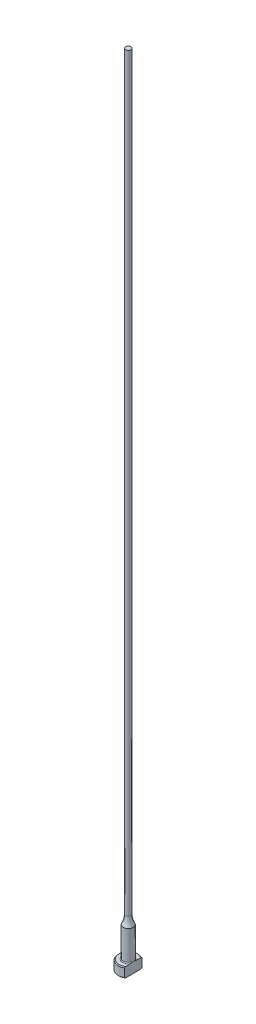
SolidWorks part; units mm, degrees
ref_plane "Front Plane" through (0, 0, 0) normal (0, 0, 1) x (1, 0, 0)
ref_plane "Top Plane" through (0, 0, 0) normal (0, 1, 0) x (1, 0, 0)
ref_plane "Right Plane" through (0, 0, 0) normal (1, 0, 0) x (0, 0, -1)
sketch "Sketch1" plane through (0, 0, 0) normal (0, 0, 1) x (1, 0, 0)
  line L0 (0, 259.9588) -> (0, -15.1925) construction
  line L1 (0, 0) -> (-3.175, 0)
  line L2 (-3.175, 0) -> (-3.175, 3.175)
  line L3 (-3.175, 3.175) -> (-1.5875, 3.175)
  line L4 (-0.8572, 15.6565) -> (-0.8572, 254)
  line L5 (-0.8572, 254) -> (0, 254)
  line L6 (0, 254) -> (0, 0)
  line L7 (-1.5875, 3.175) -> (-1.5875, 12.7)
  arc A0 (-1.5875, 12.7) -> (-0.8572, 15.6565) centre (-7.2072, 15.6565) ccw
  point P13 (-1.5875, 0)
  dimension "D1" = 6.35
  dimension "L" = 254
  dimension "D2" = 3.175
  dimension "H" = 6.35
  dimension "T" = 3.175
  dimension "D" = 1.7145
  dimension "S" = 12.7
revolve "Revolve1" add sketch "Sketch1" angle 360 about L0
chamfer "Chamfer1" distance 0.254 angle 45 2 edges at (0, 3.175, 3.175) (0, 0, 3.175)
fillet "Fillet1" radius 0.254 1 edges at (0, 3.175, 1.5875)
sketch "Sketch2" plane through (0, 0, 0) normal (0, 1, 0) x (1, 0, 0)
  line L0 (1.5875, -2.7496) -> (1.5875, 2.7496)
  circle A0 centre (0, 0) radius 3.175 construction
  arc A2 (1.5875, -2.7496) -> (1.5875, 2.7496) centre (0, 0) ccw
  circle A3 centre (0, 0) radius 3.175 construction
  circle A4 centre (0, 0) radius 1.5875 construction
extrude "Key Head" cut sketch "Sketch2" along normal up to next
